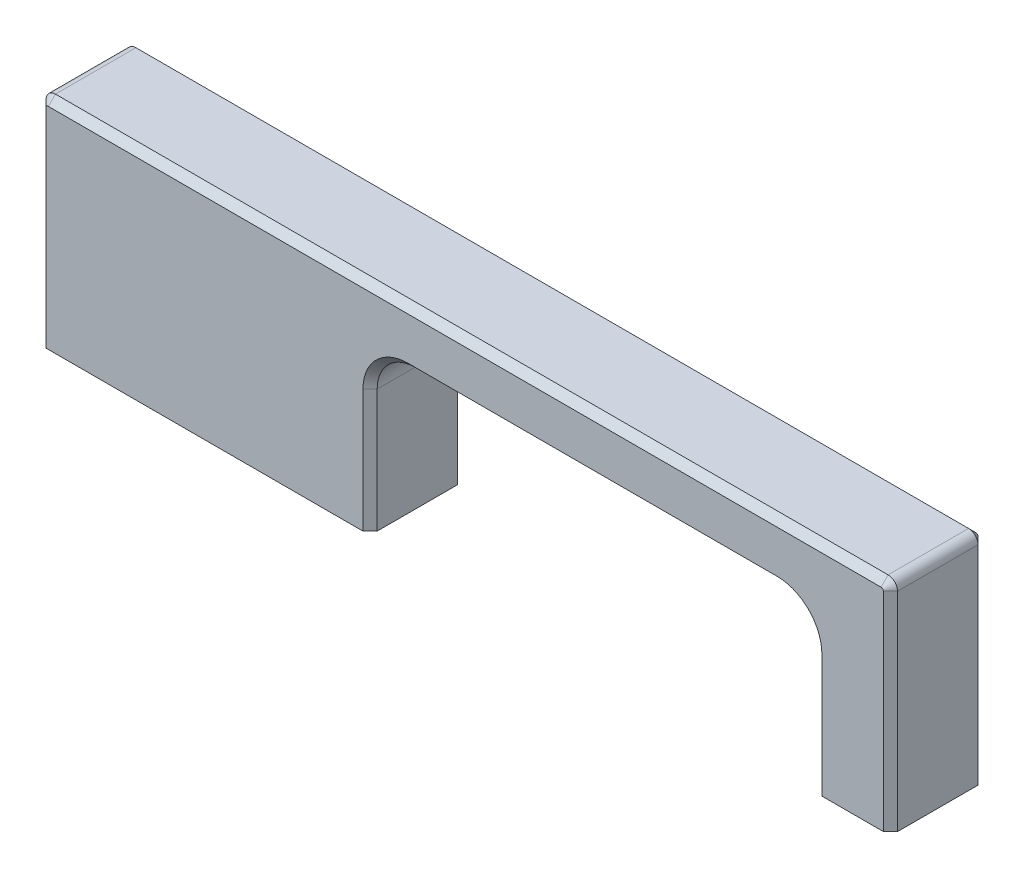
SolidWorks part; units mm, degrees
ref_plane "正面" through (0, 0, 0) normal (0, 0, 1) x (1, 0, 0)
ref_plane "平面" through (0, 0, 0) normal (0, 1, 0) x (1, 0, 0)
ref_plane "右側面" through (0, 0, 0) normal (1, 0, 0) x (0, 0, -1)
sketch "ｽｹｯﾁ1" plane through (0, 0, 0) normal (0, 0, 1) x (1, 0, 0)
  line L0 (45, 0) -> (37, 0)
  line L1 (37, 0) -> (37, 17)
  line L2 (37, 17) -> (-10, 17)
  line L3 (-10, 17) -> (-10, 0)
  line L4 (-10, 0) -> (-45, 0)
  line L5 (-45, 0) -> (-45, 23)
  line L6 (-45, 23) -> (45, 23)
  line L7 (45, 23) -> (45, 0)
  line L8 (0, 0) -> (0, 5.2386) construction
  point P11 (80.3612, 13.5654)
  point P12 (73.199, 16.86)
  point P13 (67.0395, 0)
  point P14 (55.2935, 0)
  point P15 (49.9935, 0)
  point P16 (-54.1446, 0)
  point P17 (-16.4715, 0)
  dimension "D1" = 8
  dimension "D2" = 90
  dimension "D3" = 23
  dimension "D4" = 6
  dimension "D5" = 35
extrude "ﾎﾞｽ - 押し出し1" add sketch "ｽｹｯﾁ1" along normal mid plane 10
hole_wizard "M4x0.7 ねじ穴1" positions "ｽｹｯﾁ2" profile "ｽｹｯﾁ3" tap size "M4x0.7" standard "Ansi Metric"
sketch "ｽｹｯﾁ2" plane through (0, 0, 0) normal (0, -1, 0) x (-1, 0, 0)
  line L0 (19, 0) -> (-41, 0) construction
  line L2 (-37, -5) -> (-37, 5) construction
  point P0 (-41, 0)
  point P2 (19, 0)
  dimension "D1" = 4
  dimension "D2" = 60
sketch "ｽｹｯﾁ3" plane through (41, 0, 0) normal (1, 0, 0) x (0, 0, -1)
  line L0 (0, 0) -> (0, 12.4914)
  line L1 (0, 12.4914) -> (1.65, 11.5)
  line L2 (1.65, 11.5) -> (1.65, 0)
  line L5 (1.65, 0) -> (0, 0)
  line L10 (0, 12.4914) -> (-1.65, 11.5) construction
  line L11 (0, -6.35) -> (0, 107.95) construction
  dimension "ねじ下穴ﾄﾞﾘﾙ直径" = 3.3
  dimension "ねじ下穴ﾄﾞﾘﾙの深さ" = 11.5
  dimension "ﾄﾞﾘﾙ角度" = 118
fillet "ﾌｨﾚｯﾄ1" radius 4 2 edges at (37, 17, 0) (-10, 17, 0)
fillet "ﾌｨﾚｯﾄ2" radius 1 2 edges at (45, 23, 0) (-45, 23, 0)
chamfer "面取り1" distance 0.75 angle 45 20 edges at (37, 6.5, -5) (35.8284, 15.8284, -5) (13.5, 17, -5) (-8.8284, 15.8284, -5) (-10, 6.5, -5) (45, 11, -5) (44.7071, 22.7071, -5) (0, 23, -5) (-44.7071, 22.7071, -5) (-45, 11, -5) (37, 6.5, 5) (35.8284, 15.8284, 5) (13.5, 17, 5) (-8.8284, 15.8284, 5) (-10, 6.5, 5) (45, 11, 5) (44.7071, 22.7071, 5) (0, 23, 5) (-44.7071, 22.7071, 5) (-45, 11, 5)
